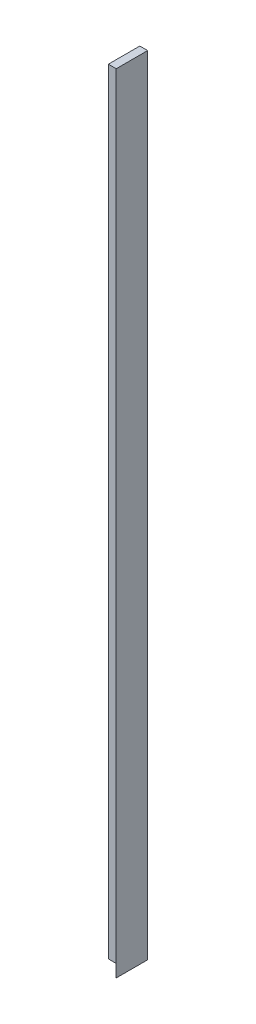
SolidWorks part; units mm, degrees
ref_plane "Front Plane" through (0, 0, 0) normal (0, 0, 1) x (1, 0, 0)
ref_plane "Top Plane" through (0, 0, 0) normal (0, 1, 0) x (1, 0, 0)
ref_plane "Right Plane" through (0, 0, 0) normal (1, 0, 0) x (0, 0, -1)
sketch "Sketch1" plane through (0, 0, 0) normal (1, 0, 0) x (0, 0, -1)
  line L1 (-12.7, 317.5) -> (12.7, 317.5)
  line L2 (-12.7, 317.5) -> (-12.7, -317.5)
  line L3 (-12.7, -317.5) -> (12.7, -317.5)
  line L4 (12.7, 317.5) -> (12.7, -317.5)
  line L5 (-12.7, 317.5) -> (12.7, -317.5) construction
  line L6 (-12.7, -317.5) -> (12.7, 317.5) construction
  point P0 (0, 0)
  dimension "D1" = 25.4
  dimension "D2" = 635
extrude "Boss-Extrude1" add sketch "Sketch1" along normal blind 6.35
sketch "Sketch2" plane through (0, -317.5, 0) normal (0, -1, 0) x (1, 0, 0)
  line L0 (6.35, 12.7) -> (0, 12.7) construction
  line L1 (0, -12.7) -> (6.333, -12.7)
  line L2 (0, -12.7) -> (0, 12.7)
  line L3 (0, 12.7) -> (6.333, 12.7)
  line L4 (6.333, -12.7) -> (6.333, 12.7)
extrude "Cut-Extrude1" cut sketch "Sketch2" against normal blind 10.16
